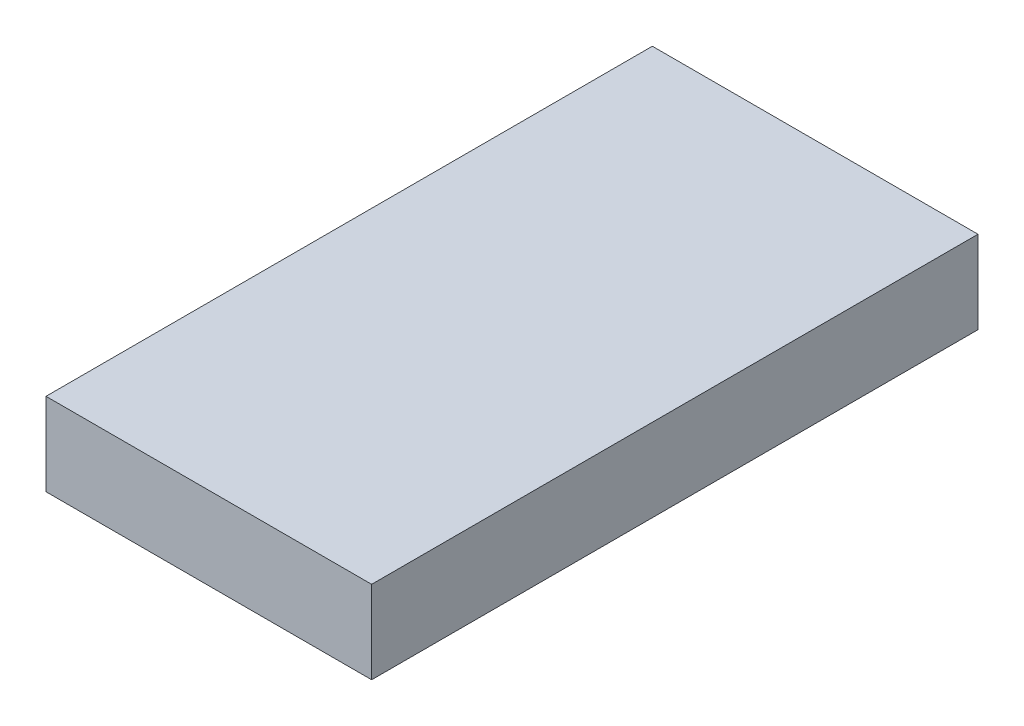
SolidWorks part; units mm, degrees
ref_plane "Front" through (0, 0, 0) normal (0, 0, 1) x (1, 0, 0)
ref_plane "Top" through (0, 0, 0) normal (0, 1, 0) x (1, 0, 0)
ref_plane "Right" through (0, 0, 0) normal (1, 0, 0) x (0, 0, -1)
sketch "Sketch1" plane through (0, 0, 0) normal (0, 1, 0) x (1, 0, 0)
  line L1 (0, 0) -> (600.2, 0)
  line L2 (0, 0) -> (0, 1117.6)
  line L3 (0, 1117.6) -> (600.2, 1117.6)
  line L4 (600.2, 0) -> (600.2, 1117.6)
  dimension "D1" = 600.2
  dimension "D2" = 1117.6
extrude "Extrude1" add sketch "Sketch1" along normal blind 152.4
